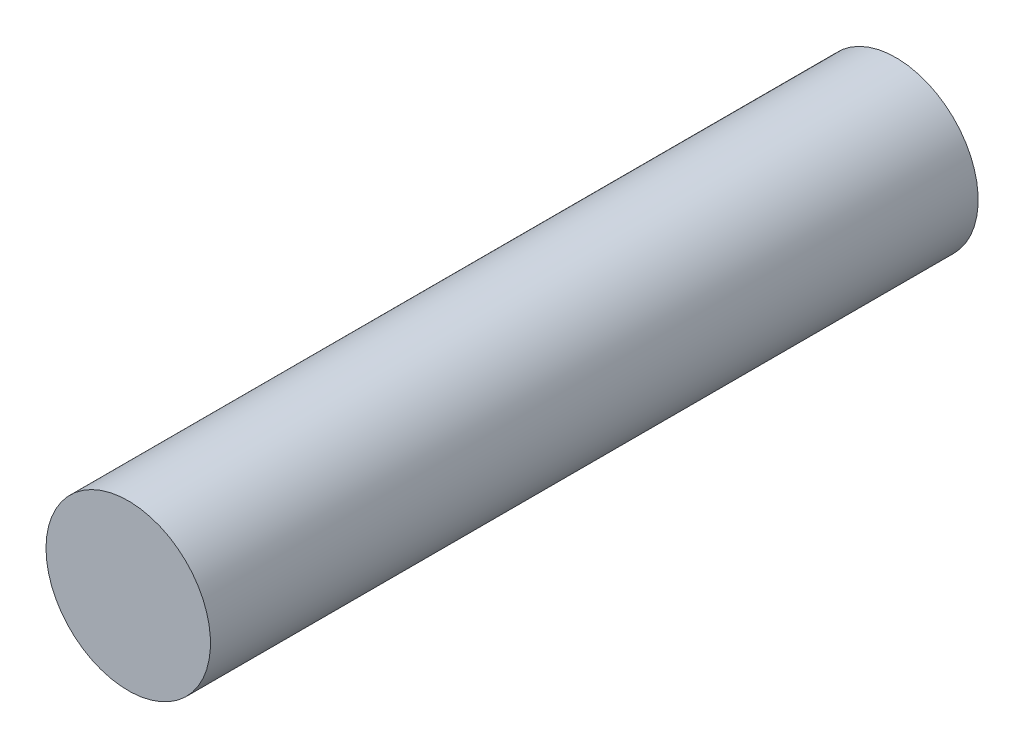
SolidWorks part; units mm, degrees
ref_plane "Ebene vorne" through (0, 0, 0) normal (0, 0, 1) x (1, 0, 0)
ref_plane "Ebene oben" through (0, 0, 0) normal (0, 1, 0) x (1, 0, 0)
ref_plane "Ebene rechts" through (0, 0, 0) normal (1, 0, 0) x (0, 0, -1)
sketch "Skizze1" plane through (0, 0, 0) normal (0, 0, 1) x (1, 0, 0)
  circle A0 centre (0, 0) radius 2.25
extrude "Linear austragen1" add sketch "Skizze1" along normal blind 21
sketch "Skizze2" plane through (0, 0, 21) normal (0, 0, 1) x (1, 0, 0)
  point P0 (0, 0)
